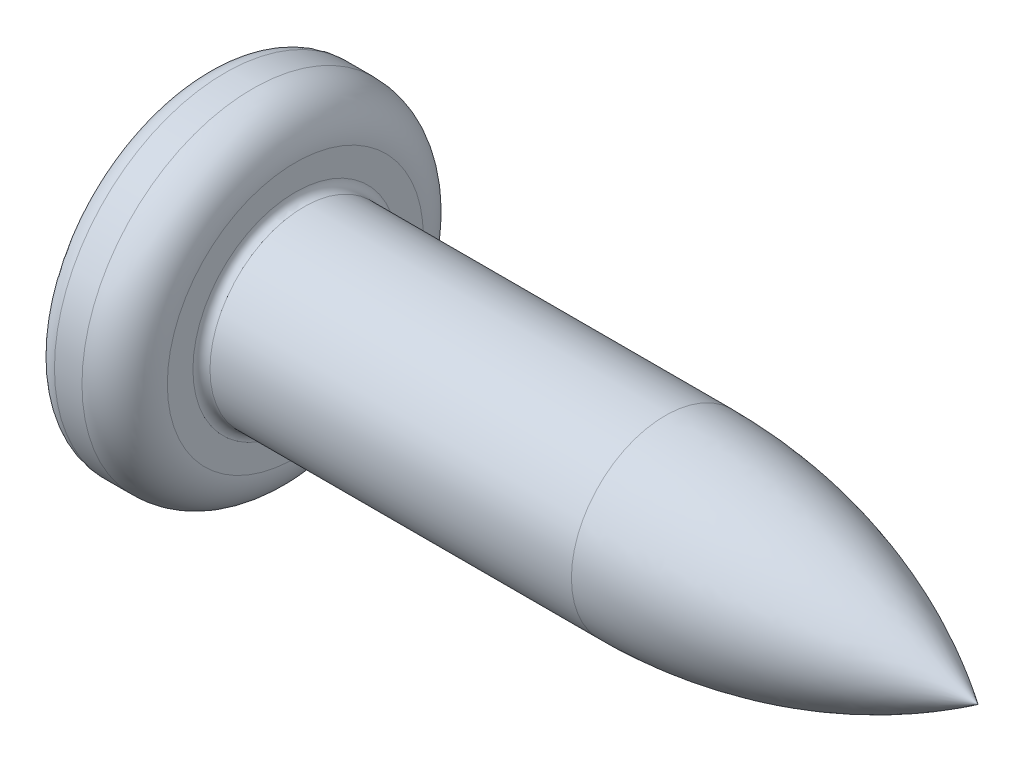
SolidWorks part; units mm, degrees
ref_plane "Plane1" through (0, 0, 0) normal (0, 0, 1) x (1, 0, 0)
ref_plane "Plane2" through (0, 0, 0) normal (0, 1, 0) x (1, 0, 0)
ref_plane "Plane3" through (0, 0, 0) normal (1, 0, 0) x (0, 0, -1)
revolve "Base-Revolve" add sketch "BodySke"
sketch "BodySke" plane through (0, 0, 0) normal (0, 0, 1) x (1, 0, 0)
  line L0 (1.5, 1.1) -> (1.5, 1.5)
  line L1 (1.725, 6.35) -> (1.725, -3.175) construction
  line L2 (-25.4, 0) -> (127, 0) construction
  line L3 (9.5, 0) -> (0, 0)
  line L4 (1.5, 1.1) -> (5.8354, 1.1)
  line L6 (0.6774, 2) -> (1, 2)
  line L8 (2.1, 6.35) -> (2.1, -3.175) construction
  arc A0 (0.4653, 1.8723) -> (0, 0) centre (4, 0) ccw
  arc A1 (9.5, 0) -> (5.8354, 1.1) centre (5.8354, -5.5544) ccw
  arc A2 (0.4653, 1.8723) -> (0.6774, 2) centre (0.6774, 1.76) cw
  arc A3 (1.5, 1.5) -> (1, 2) centre (1, 1.5) ccw
  point P19 (1.5, 2)
  dimension "Head_fillet_rad" = 0.24
  dimension "D3" = 0.5
  dimension "Head_crown_rad" = 4
  dimension "D1" = 1.1
  dimension "D2" = 8
  dimension "Head_ht" = 1.5
  dimension "Head_dia" = 4
  dimension "Advance" = 0.45
fillet "Fillet1" radius 0.1 1 edges at (1.5, 0, 1.1)
sketch "Sketch3" plane through (0, 0, 0) normal (1, 0, 0) x (0, 0, -1)
  line L0 (0.37, -1.3) -> (-0.37, -1.3)
  line L1 (0.37, -1.3) -> (0.37, 1.3)
  line L2 (-0.37, 1.3) -> (0.37, 1.3)
  line L3 (-0.37, 1.3) -> (-0.37, -1.3)
  dimension "D1" = 1.3
  dimension "Cross_dia" = 2.6
  dimension "D2" = 0.37
  dimension "Cross_width" = 0.74
ref_plane "Plane4" through (1.5, 0, 0) normal (1, 0, 0) x (0, 0, -1)
sketch "Sketch4" plane through (1.5, 0, 0) normal (1, 0, 0) x (0, 0, -1)
  line L0 (0.37, -0.5521) -> (-0.37, -0.5521)
  line L1 (0.37, -0.5521) -> (0.37, 0.5521)
  line L2 (-0.37, 0.5521) -> (0.37, 0.5521)
  line L3 (-0.37, 0.5521) -> (-0.37, -0.5521)
  dimension "D1" = 0.74
  dimension "D2" = 1.1043
  dimension "D3" = 0.37
  dimension "D4" = 0.5521
loft "Recess" cut profiles "Sketch3", "Sketch4"
pattern_circular "RecPat" count 2 every 90 about axis through (0, 0, 0) along (1, 0, 0) of "Recess"
sketch "RecCorSke" plane through (0, 0, 0) normal (0, 0, 1) x (1, 0, 0)
  line L0 (-3.175, 0) -> (15.875, 0) construction
  line L1 (-25.4, 0) -> (127, 0) construction
  line L2 (0, 0) -> (0, 0.6609)
  line L3 (0, 0.6609) -> (1.5, 0.556)
  line L4 (1.5, 0.556) -> (1.6807, 0)
  line L5 (1.6807, 0) -> (0, 0)
  dimension "Diameter" = 1.112
  dimension "Depth" = 1.5
  dimension "Draft_angle" = 4
  dimension "Bottom_angle" = 18
revolve "RecessCore" cut sketch "RecCorSke" angle 360 about L0
sketch "ThdSchSke" plane through (0, 0, 0) normal (0, 0, 1) x (1, 0, 0)
  line L0 (3, -0.9965) -> (2.8225, -1.25)
  line L1 (3, -0.9965) -> (3.1775, -1.25)
  line L2 (3.1775, -1.25) -> (3.1775, -1.5625)
  line L3 (-3.175, 0) -> (5.1513, 0) construction
  line L5 (3.1775, -1.5625) -> (2.8225, -1.5625)
  line L6 (2.8225, -1.5625) -> (2.8225, -1.25)
  dimension "Thread_minor" = 1.993
  dimension "Diameter" = 2.5
  dimension "Start" = 3
  dimension "SideAngle" = 55
  dimension "VeeAngle" = 70
  dimension "Overcut" = 3.125
revolve "ThreadSchematic" cut sketch "ThdSchSke" angle 360 about L3
pattern_linear "ThdSchPat"
